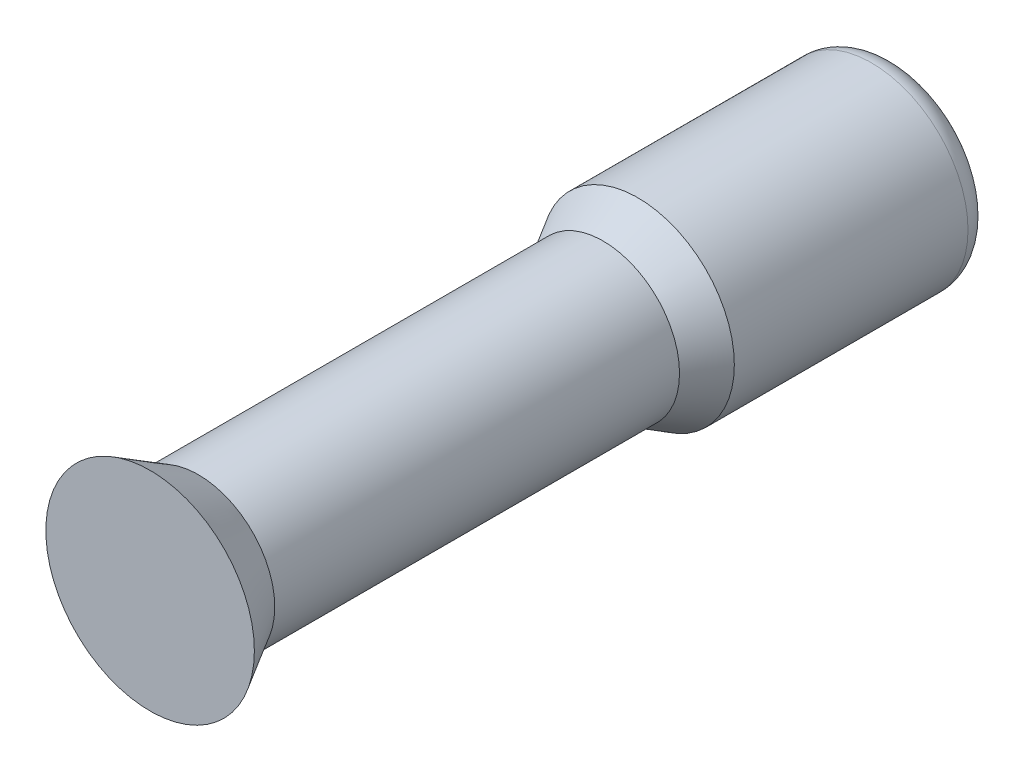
SolidWorks part; units mm, degrees
ref_plane "Спереди" through (0, 0, 0) normal (0, 0, 1) x (1, 0, 0)
ref_plane "Сверху" through (0, 0, 0) normal (0, 1, 0) x (1, 0, 0)
ref_plane "Справа" through (0, 0, 0) normal (1, 0, 0) x (0, 0, -1)
sketch "Эскиз1" plane through (0, 0, 0) normal (1, 0, 0) x (0, 0, -1)
  line L0 (0, 0) -> (63.3691, 0) construction
  line L1 (0, 0) -> (12.2674, 0)
  line L2 (11.8705, 1.5875) -> (8.0256, 1.5875)
  line L3 (8.0256, 1.5875) -> (7.4536, 1.2573)
  line L4 (7.4536, 1.2573) -> (0.7937, 1.2573)
  line L5 (0.7937, 1.2573) -> (0, 1.7156)
  line L6 (12.2674, 1.1906) -> (12.2674, 0)
  line L7 (0, 0) -> (0, 1.7156)
  arc A1 (11.8705, 1.5875) -> (12.2674, 1.1906) centre (11.8705, 1.1906) cw
  dimension "D9" = 0.3969
  dimension "D1" = 3.175
  dimension "D2" = 2.5146
  dimension "D3" = 30
  dimension "D4" = 30
  dimension "D6" = 4.2418
  dimension "D7" = 6.6599
  dimension "D8" = 0.7937
revolve "Повернуть1" add sketch "Эскиз1" angle 360 about L0
